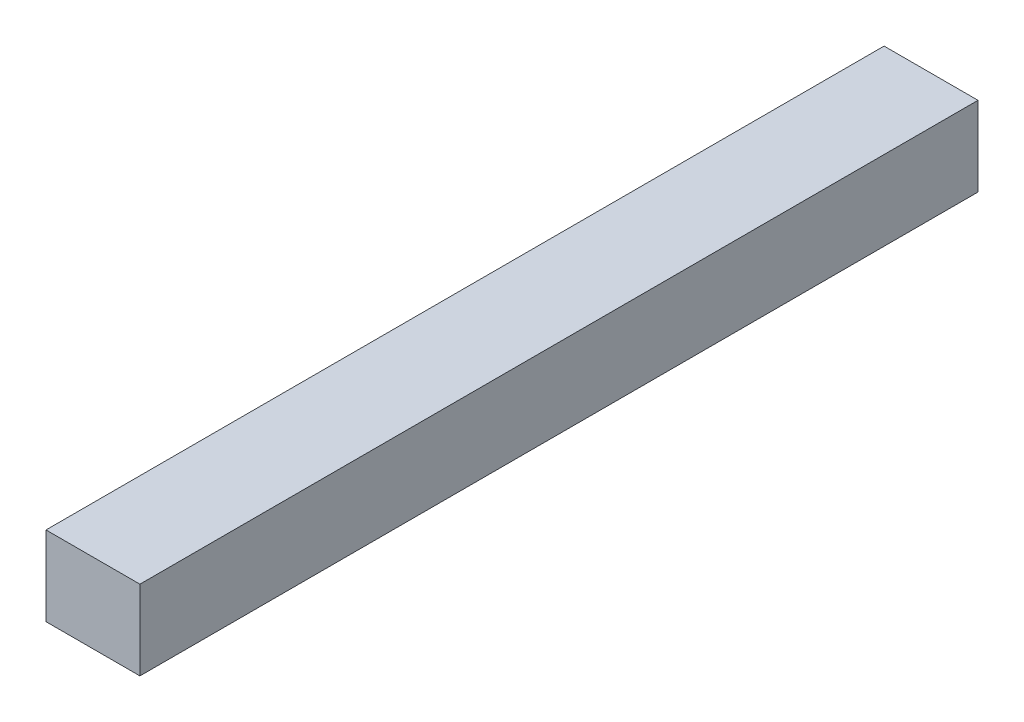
SolidWorks part; units mm, degrees
ref_plane "Plan de face" through (0, 0, 0) normal (0, 0, 1) x (1, 0, 0)
ref_plane "Plan de dessus" through (0, 0, 0) normal (0, 1, 0) x (1, 0, 0)
ref_plane "Plan de droite" through (0, 0, 0) normal (1, 0, 0) x (0, 0, -1)
sketch "Esquisse1" plane through (0, 0, 0) normal (0, 0, 1) x (1, 0, 0)
  line L1 (-32.5, 27.5) -> (32.5, 27.5)
  line L2 (-32.5, 27.5) -> (-32.5, -27.5)
  line L3 (-32.5, -27.5) -> (32.5, -27.5)
  line L4 (32.5, 27.5) -> (32.5, -27.5)
  line L5 (-32.5, 27.5) -> (32.5, -27.5) construction
  line L6 (-32.5, -27.5) -> (32.5, 27.5) construction
  point P0 (0, 0)
  dimension "D1" = 65
  dimension "D2" = 55
extrude "Boss.-Extru.1" add sketch "Esquisse1" along normal blind 580
